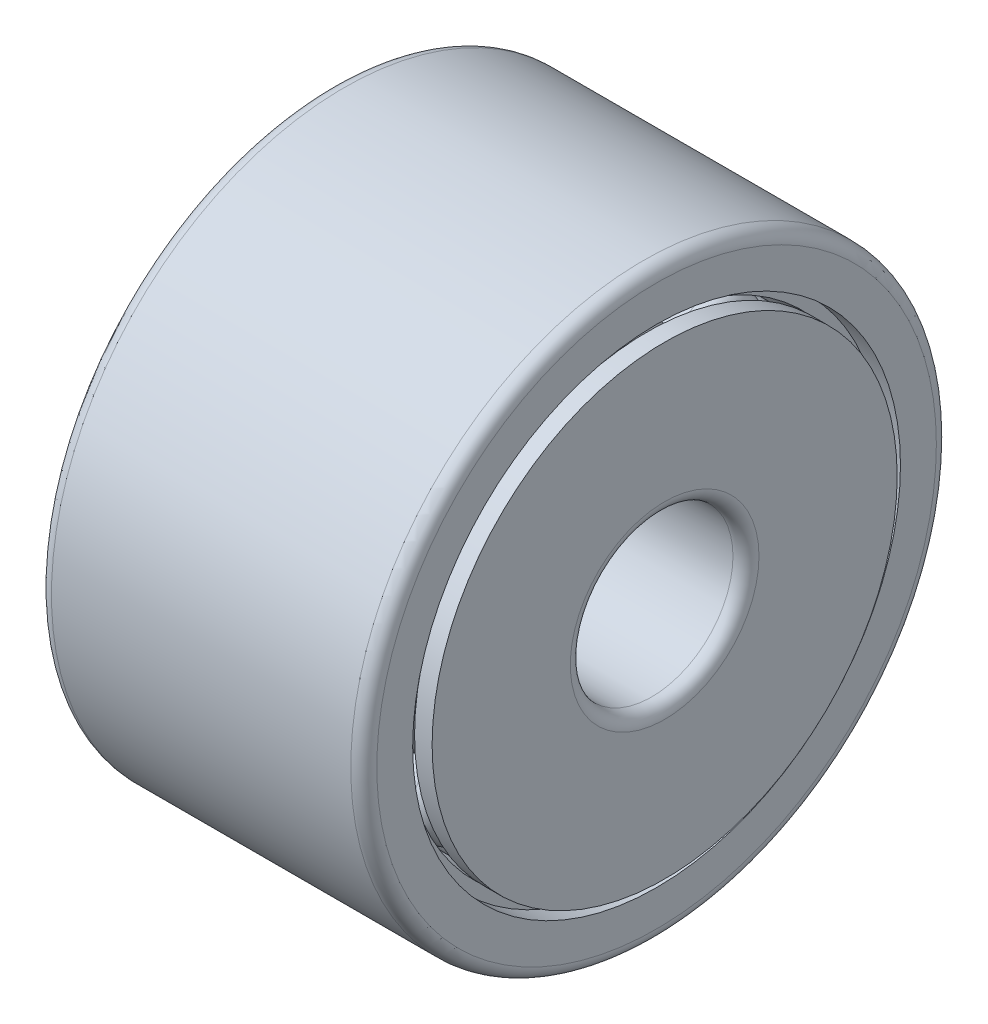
SolidWorks part; units mm, degrees
ref_plane "Plane1" through (0, 0, 0) normal (0, 0, 1) x (1, 0, 0)
ref_plane "Plane2" through (0, 0, 0) normal (0, 1, 0) x (1, 0, 0)
ref_plane "Plane3" through (0, 0, 0) normal (1, 0, 0) x (0, 0, -1)
sketch "Clipboard" plane through (0, 0, 0) normal (0, 0, 1) x (1, 0, 0)
  line L0 (-10, 0) -> (10, 0) construction
  line L1 (0, 0) -> (27.0344, -5.7463)
  line L2 (0, 0) -> (22.4793, 28.7722)
  line L3 (0, 0) -> (27.9428, -35.7651)
  line L4 (0, 0) -> (-22.3471, -0.7804)
sketch "OutRacSke" plane through (0, 0, 0) normal (0, 0, 1) x (1, 0, 0)
  line L0 (-14.0229, 22.6933) -> (-14.0229, 23.8026)
  line L1 (-14.0229, 23.8026) -> (-15.875, 23.8026)
  line L2 (-15.875, 23.8026) -> (-15.875, 27.305)
  line L3 (-14.605, 28.575) -> (14.605, 28.575)
  line L4 (15.875, 27.305) -> (15.875, 23.8026)
  line L5 (15.875, 23.8026) -> (14.0229, 23.8026)
  line L6 (14.0229, 23.8026) -> (14.0229, 22.6933)
  line L7 (14.0229, 22.6933) -> (-14.0229, 22.6933)
  line L8 (-7.9375, 0) -> (7.9375, 0) construction
  arc A0 (-15.875, 27.305) -> (-14.605, 28.575) centre (-14.605, 27.305) cw
  arc A1 (14.605, 28.575) -> (15.875, 27.305) centre (14.605, 27.305) cw
revolve "OuterRace" add sketch "OutRacSke" angle 360 about L8
sketch "RolDetSke" plane through (0, 0, 0) normal (0, 0, 1) x (1, 0, 0)
  line L0 (-14.0229, 20.9188) -> (-14.0229, 18.2562)
  line L1 (-14.0229, 18.2562) -> (14.0229, 18.2562)
  line L2 (14.0229, 18.2562) -> (14.0229, 20.9188)
  line L3 (12.2479, 22.6938) -> (-12.2479, 22.6938)
  line L4 (-28.575, 18.2562) -> (28.575, 18.2562) construction
  arc A0 (14.0229, 20.9188) -> (12.2479, 22.6938) centre (12.2479, 20.9188) ccw
  arc A1 (-12.2479, 22.6938) -> (-14.0229, 20.9188) centre (-12.2479, 20.9188) ccw
revolve "RollerDetailed" add sketch "RolDetSke" angle 360 about L4
ref_axis "Axis1" through (-50, 0, 0) along (1, 0, 0)
pattern_circular "RollersDetailed" count 12 every 30 about axis through (-50, 0, 0) along (1, 0, 0) of "RollerDetailed", "OuterRace"
sketch "RolSimSke" plane through (0, 25.4, 0) normal (0, 0, 1) x (1, 0, 0)
  line L0 (-14.0229, -4.4807) -> (-14.0229, -9.8058)
  line L1 (-25.4, -25.4) -> (25.4, -25.4) construction
  line L2 (14.0229, -9.8058) -> (14.0229, -4.4807)
  line L3 (12.2479, -2.7057) -> (-12.2479, -2.7057)
  line L5 (12.2479, -11.5808) -> (-12.2479, -11.5808)
  arc A0 (14.0229, -4.4807) -> (12.2479, -2.7057) centre (12.2479, -4.4807) ccw
  arc A1 (-12.2479, -2.7057) -> (-14.0229, -4.4807) centre (-12.2479, -4.4807) ccw
  arc A2 (14.0229, -9.8058) -> (12.2479, -11.5808) centre (12.2479, -9.8058) cw
  arc A3 (-12.2479, -11.5808) -> (-14.0229, -9.8058) centre (-12.2479, -9.8058) cw
revolve "RollersSimplified" [suppressed] add sketch "RolSimSke" angle 360 about L1
sketch "InsRacSke" plane through (0, 0, 0) normal (0, 0, 1) x (1, 0, 0)
  line L0 (-14.949, 13.8192) -> (-14.949, 22.6933)
  line L1 (-14.949, 22.6933) -> (-16.6624, 22.6933)
  line L2 (-16.6624, 22.6933) -> (-16.6624, 9.2075)
  line L3 (-15.3924, 7.9375) -> (-0.84, 7.9375)
  line L4 (0.84, 7.9375) -> (15.3924, 7.9375)
  line L5 (16.6624, 9.2075) -> (16.6624, 22.6933)
  line L6 (16.6624, 22.6933) -> (14.949, 22.6933)
  line L7 (14.949, 22.6933) -> (14.949, 13.8192)
  line L8 (14.949, 13.8192) -> (-14.949, 13.8192)
  line L9 (-7.9375, 0) -> (7.9375, 0) construction
  arc A0 (-16.6624, 9.2075) -> (-15.3924, 7.9375) centre (-15.3924, 9.2075) ccw
  arc A1 (-0.84, 7.9375) -> (0.84, 7.9375) centre (0, 6.985) cw
  arc A2 (15.3924, 7.9375) -> (16.6624, 9.2075) centre (15.3924, 9.2075) ccw
revolve "InnerRace" add sketch "InsRacSke" angle 360 about L9
equation "\"halfWidth@OutRacSke\" =  \"Width@OutRacSke\" / 2"
equation "\"CLdia@Clipboard\" =  ( \"Race_OD@Clipboard\" + \"Race_ID@Clipboard\" )  / 2"
equation "\"CLRad@RolDetSke\" = ( \"Race_OD@Clipboard\" + \"Race_ID@Clipboard\" )  / 4"
equation "\"Roller_diameter@RolDetSke\" =  ( \"Race_OD@Clipboard\" -  \"Race_ID@Clipboard\" )  / 2 + .001"
equation "\"Roller_diameter@RolSimSke\" = ( \"Race_OD@Clipboard\" -  \"Race_ID@Clipboard\" )  / 2 + .001"
equation "\"radius@RolDetSke\" = \"Roller_diameter@RolDetSke\" / 5"
equation "\"radius@RolSimSke\" = \"Roller_diameter@RolSimSke\" / 5"
equation "\"Cyl_Len@OutRacSke\" = \"Cyl_Len@RolDetSke\""
equation "\"Cyl_Len@RolSimSke\" = \"Cyl_Len@RolDetSke\""
equation "\"halfCylLen@RolDetSke\" = \"Cyl_Len@RolDetSke\" / 2"
equation "\"offset@InsRacSke\" = \"radius@InsRacSke\" * 0.75"
equation "\"SlotWidth@InsRacSke\" =  ( \"Width@OutRacSke\" + \"Cyl_Len@RolDetSke\" )  / 2"
equation "\"halfSlotWidth@InsRacSke\" = \"SlotWidth@InsRacSke\" / 2"
equation "\"D1@OutRacSke\" = \"Cyl_Len@OutRacSke\" / 2"
equation "\"Max_count@Clipboard\" = int( 3.14159265 / atn(( \"Roller_diameter@RolDetSke\" / 2) / sqr( \"CLRad@RolDetSke\"  *  \"CLRad@RolDetSke\" - ( \"Roller_diameter@RolDetSke\" / 2) *  ( \"Roller_diameter@RolDetSke\" / "
equation "\"Max_count@Clipboard\" = ((sgn( \"Max_count@Clipboard\" - \"Count@Clipboard\" )-1)*( \"Max_count@Clipboard\" - \"Count@Clipboard\" ))/-2+ \"Count@Clipboard\""
equation "\"Count@RollersDetailed\" = int( \"Show_count@Clipboard\" ) "
equation "\"Count@RollersDetailed\" = ((sgn( \"Count@RollersDetailed\" - \"Max_count@Clipboard\" )-1)*( \"Count@RollersDetailed\" - \"Max_count@Clipboard\" ))/-2+ \"Max_count@Clipboard\""
equation "\"Count@RollersDetailed\" = ((sgn( \"Count@RollersDetailed\" - \"Min_count@Clipboard\" )+1)*( \"Count@RollersDetailed\" - \"Min_count@Clipboard\"))/2 +\"Min_count@Clipboard\""
equation "\"Angle@RollersDetailed\" = 360.0 / \"Max_count@Clipboard\""
equation "\"Bore@RolSimSke\" = \"Race_ID@Clipboard\""
equation "\"Race_ID@InsRacSke\" = \"Race_ID@Clipboard\""
equation "\"Race_OD@InsRacSke\" = \"Race_OD@Clipboard\""
equation "\"halfWidth@InsRacSke\" = \"Width_IR@InsRacSke\" / 2"
equation "\"halfLength@RolSimSke\" = \"Cyl_Len@RolSimSke\" / 2"
equation "\"Race_OD@OutRacSke\" = \"Race_OD@Clipboard\""
